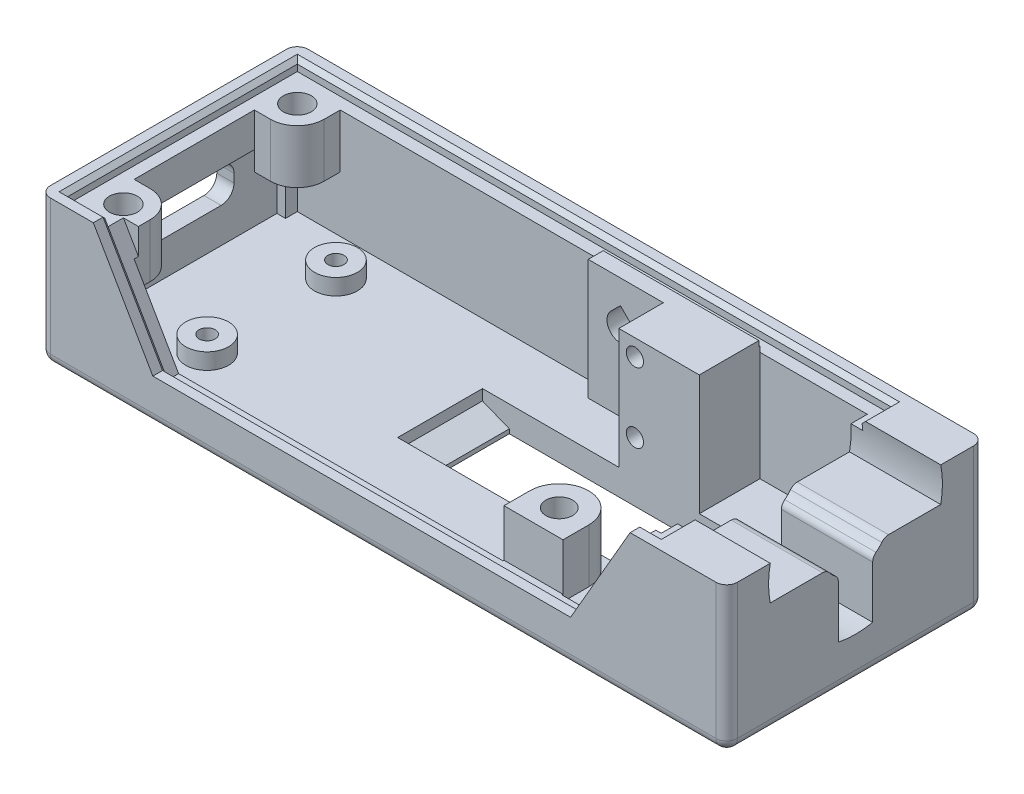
SolidWorks part; units mm, degrees
ref_plane "Ebene vorne" through (0, 0, 0) normal (0, 0, 1) x (1, 0, 0)
ref_plane "Ebene oben" through (0, 0, 0) normal (0, 1, 0) x (1, 0, 0)
ref_plane "Ebene rechts" through (0, 0, 0) normal (1, 0, 0) x (0, 0, -1)
sketch "Skizze1" plane through (0, 0, 0) normal (0, 1, 0) x (1, 0, 0)
  line L0 (-64, 12) -> (0, 12)
  line L1 (-64, 12) -> (-64, -12)
  line L2 (0, 12) -> (0, -12)
  line L3 (-64, -12) -> (0, -12)
  point P0 (0, 0)
  point P1 (-23.1368, 0)
  dimension "D1" = 24
  dimension "D2" = 64
extrude "Aufsatz-Linear austragen1" add sketch "Skizze1" along normal blind 2.4
sketch "Skizze2" plane through (0, 2.4, 0) normal (0, 1, 0) x (1, 0, 0)
  line L1 (0, 12) -> (-64, 12)
  line L2 (0, 12) -> (0, -12)
  line L3 (0, -12) -> (-64, -12)
  line L4 (-64, 12) -> (-64, -12)
  line L5 (-61.6, 9.6) -> (-8.5, 9.6)
  line L6 (-61.6, 9.6) -> (-61.6, -9.6)
  line L7 (-61.6, -9.6) -> (-8.5, -9.6)
  line L8 (-8.5, 9.6) -> (-8.5, -9.6)
  dimension "D1" = 8.5
  dimension "D2" = 2.4
  dimension "D3" = 2.4
  dimension "D4" = 2.4
extrude "Aufsatz-Linear austragen2" add sketch "Skizze2" along normal blind 11.2
sketch "Skizze3" plane through (0, 0, 0) normal (1, 0, 0) x (0, 0, -1)
  line L0 (-12, 0) -> (12, 0) construction
  line L2 (-8.1, 12) -> (8.1, 12) construction
  line L3 (-7.9404, 13.6) -> (7.9404, 13.6)
  line L5 (-7.9404, 10.4) -> (-3.0741, 10.4)
  line L6 (7.9404, 10.4) -> (3.0741, 10.4)
  line L7 (0, 0) -> (0, 12) construction
  line L8 (-1.6, 4.0596) -> (-1.6, 8.9259)
  line L9 (1.6, 8.9259) -> (1.6, 4.0596)
  arc A0 (-2.4435, 10.0923) -> (-1.9077, 9.5565) centre (0, 12) ccw
  arc A1 (-7.9404, 13.6) -> (-7.9404, 10.4) centre (0, 12) ccw
  arc A2 (-1.6, 4.0596) -> (1.6, 4.0596) centre (0, 12) ccw
  arc A3 (7.9404, 10.4) -> (7.9404, 13.6) centre (0, 12) ccw
  arc A4 (1.9077, 9.5565) -> (2.4435, 10.0923) centre (0, 12) ccw
  arc A5 (3.0741, 10.4) -> (2.4435, 10.0923) centre (3.0741, 9.6) ccw
  arc A6 (1.6, 8.9259) -> (1.9077, 9.5565) centre (2.4, 8.9259) cw
  arc A7 (-1.6, 8.9259) -> (-1.9077, 9.5565) centre (-2.4, 8.9259) ccw
  arc A8 (-3.0741, 10.4) -> (-2.4435, 10.0923) centre (-3.0741, 9.6) cw
  point P11 (2.6552, 10.4)
  point P21 (1.6, 9.3448)
  point P26 (-2.6552, 10.4)
  dimension "D1" = 12
  dimension "D2" = 6.2
  dimension "D3" = 16.2
  dimension "D8" = 0.8
  dimension "D4" = 3.2
  dimension "D5" = 1.6
  dimension "D6" = 3.2
  dimension "D7" = 1.6
extrude "Kopf_Loch" cut sketch "Skizze3" against normal up to surface (8.5 mm away)
sketch "Skizze5" plane through (0, 2.4, 0) normal (0, 1, 0) x (1, 0, 0)
  line L0 (-8.5, 9.6) -> (-61.6, 9.6) construction
  line L1 (-26, 9.6) -> (-18.5, 9.6)
  line L2 (-26, 9.6) -> (-26, 3.95)
  line L3 (-26, 3.95) -> (-18.5, 3.95)
  line L4 (-18.5, 9.6) -> (-18.5, 3.95)
  line L6 (-8.5, -9.6) -> (-8.5, 9.6) construction
  dimension "D1" = 10
  dimension "D2" = 7.5
  dimension "D3" = 5.65
extrude "Aufsatz-Linear austragen3" add sketch "Skizze5" along normal up to surface (11.2 mm away)
sketch "Skizze7" plane through (0, 0, -3.95) normal (0, 0, 1) x (1, 0, 0)
  line L0 (-26, 13.6) -> (-26, 2.4) construction
  line L2 (-24.5, 12.05) -> (-24.5, 5.55) construction
  line L5 (-26, 2.4) -> (-18.5, 2.4) construction
  circle A0 centre (-24.5, 12.05) radius 0.8
  circle A1 centre (-24.5, 5.55) radius 0.8
  dimension "D1" = 1.6
  dimension "D2" = 1.6
  dimension "D3" = 6.5
  dimension "D4" = 1.5
  dimension "D5" = 3.15
extrude "Schnitt-Linear austragen2" cut sketch "Skizze7" against normal blind 5
sketch "Skizze8" plane through (-26, 0, 0) normal (-1, 0, 0) x (0, 0, 1)
  line L0 (-9.6, 13.6) -> (-9.6, 2.4) construction
  line L1 (-9.6, 2.4) -> (-3.95, 2.4) construction
  line L2 (-5.1, 10.6678) -> (-5.9839, 9.7839)
  line L3 (-5.1, 10.6678) -> (-4.2161, 9.7839)
  line L4 (-5.1, 8.9) -> (-5.1, 10.6678) construction
  line L5 (-12, 0) -> (12, 0) construction
  arc A0 (-5.9839, 9.7839) -> (-4.2161, 9.7839) centre (-5.1, 8.9) ccw
  dimension "D2" = 6.5
  dimension "D3" = 2.5
  dimension "D1" = 4.5
  dimension "D4" = 90
  dimension "D5" = 90
extrude "Schnitt-Linear austragen3" [suppressed] cut sketch "Skizze8" against normal up to surface (7.5 mm away)
sketch "Skizze9" plane through (0, 0, 12) normal (0, 0, 1) x (1, 0, 0)
  line L0 (-59, 13.6) -> (-53.4574, 4)
  line L1 (-64, 13.6) -> (0, 13.6) construction
  line L2 (-53.4574, 4) -> (-14.5426, 4)
  line L3 (-14.5426, 4) -> (-9, 13.6)
  line L4 (-9, 13.6) -> (-59, 13.6)
  line L5 (-64, 13.6) -> (-64, 0) construction
  line L6 (-64, 0) -> (0, 0) construction
  line L8 (0, 13.6) -> (0, 0) construction
  dimension "D1" = 5
  dimension "D2" = 30
  dimension "D3" = 4
  dimension "D4" = 9
  dimension "D5" = 30
extrude "Schnitt-Linear austragen4" cut sketch "Skizze9" against normal up to surface (2.4 mm away)
sketch "Skizze10" plane through (0, 13.6, 0) normal (0, 1, 0) x (1, 0, 0)
  line L0 (-8.5, 7.9404) -> (-8.5, 9.6)
  line L1 (-8.5, 9.6) -> (-61.6, 9.6)
  line L2 (-61.6, 9.6) -> (-61.6, -9.6)
  line L3 (-61.6, -9.6) -> (-8.5, -9.6)
  line L4 (-8.5, -9.6) -> (-8.5, -7.9404)
  line L5 (-7.4, 7.9404) -> (-7.4, 10.7)
  line L6 (-7.4, 10.7) -> (-62.7, 10.7)
  line L7 (-62.7, 10.7) -> (-62.7, -10.7)
  line L8 (-62.7, -10.7) -> (-7.4, -10.7)
  line L9 (-7.4, -10.7) -> (-7.4, -7.9404)
  line L10 (-7.4, 7.9404) -> (-8.5, 7.9404)
  line L11 (-7.4, -7.9404) -> (-8.5, -7.9404)
  dimension "D1" = 1.1
extrude "Schnitt-Linear austragen15" cut sketch "Skizze10" against normal blind 1
sketch "Skizze19" plane through (0, 0, 9.6) normal (0, 0, -1) x (-1, 0, 0)
  line L1 (9.5774, 12.6) -> (14.5426, 4)
  line L2 (14.5426, 4) -> (9.5774, 12.6) construction
  line L3 (14.5426, 4) -> (53.4574, 4)
  line L4 (53.4574, 4) -> (58.4226, 12.6)
  line L5 (58.4226, 12.6) -> (58.4226, 11.6) construction
  line L6 (58.4226, 11.6) -> (53.4574, 3)
  line L7 (53.4574, 3) -> (14.5426, 3)
  line L8 (9, 12.6) -> (14.5426, 3)
  line L9 (14.5426, 4) -> (14.5426, 3) construction
  line L10 (8.5, 12.6) -> (9.5774, 12.6) construction
  line L11 (9.5774, 12.6) -> (9, 12.6)
  line L12 (9.5774, 12.6) -> (9.5774, 11.6) construction
  line L13 (58.4226, 11.6) -> (59, 12.6)
  line L14 (58.4226, 12.6) -> (61.6, 12.6) construction
  line L15 (59, 12.6) -> (58.4226, 12.6)
  dimension "D1" = 1
  dimension "D2" = 1
extrude "Schnitt-Linear austragen16" cut sketch "Skizze19" against normal blind 1.1
sketch "Skizze20" plane through (0, 0, -9.6) normal (0, 0, 1) x (1, 0, 0)
  line L0 (-26, 12.6) -> (-26, 2.4) construction
  line L1 (-26, 2.4) -> (-33, 2.4)
  line L2 (-26, 2.4) -> (-26, 13.6)
  line L3 (-26, 13.6) -> (-33, 13.6)
  line L4 (-33, 2.4) -> (-33, 13.6)
  line L5 (-18.5, 13.6) -> (-26, 13.6) construction
  circle A0 centre (-30, 9.6) radius 1.5 construction
  circle A1 centre (-30, 9.6) radius 2.75 construction
  dimension "D1" = 3
  dimension "D2" = 5.5
  dimension "D3" = 3
  dimension "D4" = 7
  dimension "D5" = 0
  dimension "D6" = 4
extrude "Aufsatz-Linear austragen4" add sketch "Skizze20" along normal blind 1.5 contours L4 L3 L2 L1
sketch "Skizze22" plane through (0, 0, -8.1) normal (0, 0, 1) x (1, 0, 0)
  line L0 (-30, 9.6) -> (-30, 11.3626) construction
  line L1 (-30, 11.3626) -> (-30.8813, 10.4865)
  line L2 (-30, 11.3626) -> (-29.2144, 10.5723)
  arc A0 (-30.8813, 10.4865) -> (-29.2144, 10.5723) centre (-30, 9.6) ccw
  dimension "D1" = 2.5
  dimension "D2" = 90
extrude "Schnitt-Linear austragen17" cut sketch "Skizze22" against normal blind 2.5
sketch "Skizze23" plane through (0, 13.6, 0) normal (0, 1, 0) x (1, 0, 0)
  line L0 (-3.25, 8.75) -> (-3.25, -8.75) construction
  line L1 (0, 7.9404) -> (0, 12) construction
  line L2 (0, 12) -> (-64, 12) construction
  line L3 (-9, -12) -> (0, -12) construction
  circle A0 centre (-3.25, 8.75) radius 1.25
  circle A1 centre (-3.25, -8.75) radius 1.25
  dimension "D1" = 3.25
  dimension "D2" = 3.25
  dimension "D3" = 3.25
  dimension "D4" = 2.5
  dimension "D5" = 2.5
extrude "ScrewholeFront" [suppressed] cut sketch "Skizze23" against normal blind 10
sketch "Skizze24" [suppressed] plane through (0, 2.4, 0) normal (0, 1, 0) x (1, 0, 0)
  line L3 (-20, 8) -> (-12, 8) construction
  line L9 (-8.5, 13.6) -> (-20.5, 13.6)
  line L10 (-8.5, 13.6) -> (-8.5, 2.7)
  line L11 (-8.5, 2.7) -> (-20.5, 2.7)
  line L12 (-20.5, 13.6) -> (-20.5, 2.7)
  line L13 (-8.5, -13.6) -> (-24, -13.6)
  line L14 (-8.5, -13.6) -> (-8.5, -3.6)
  line L15 (-8.5, -3.6) -> (-24, -3.6)
  line L16 (-24, -13.6) -> (-24, -3.6)
  circle A2 centre (-12, -8) radius 3.2 construction
  circle A3 centre (-20, -8) radius 3.2 construction
  circle A4 centre (-20, 0) radius 3.2 construction
  circle A5 centre (-20, 8) radius 3.2 construction
  circle A6 centre (-12, 0) radius 3.2 construction
  circle A7 centre (-12, 8) radius 3.2 construction
  point P0 (-16, 8)
  dimension "D2" = 12
  dimension "D3" = 6.4
  dimension "D4" = 10
  dimension "D1" = 8
  dimension "D7" = 0.8
  dimension "D8" = 8
  dimension "D5" = 2
  dimension "D6" = 3
extrude "Aufsatz-Linear austragen5" [suppressed] add sketch "Skizze24" along normal blind 5.4
sketch "Skizze25" [suppressed] plane through (0, 0, 0) normal (0, -1, 0) x (1, 0, 0)
  line L0 (0, 16) -> (0, -16) construction
  line L1 (-12, 8) -> (-12, -8) construction
  line L2 (-12, -8) -> (-20, -8) construction
  line L3 (-20, -8) -> (-20, 8) construction
  line L4 (-20, 8) -> (-12, 8) construction
  circle A0 centre (-12, 8) radius 2.4
  circle A1 centre (-20, 8) radius 2.4
  circle A2 centre (-20, 0) radius 2.4 construction
  circle A3 centre (-20, -8) radius 2.4
  circle A4 centre (-12, 0) radius 2.4 construction
  circle A5 centre (-12, -8) radius 2.4
  dimension "D1" = 4.8
  dimension "D2" = 12
  dimension "D5" = 8
  dimension "D6" = 8
  dimension "D3" = 2
  dimension "D4" = 3
extrude "Schnitt-Linear austragen19" [suppressed] cut sketch "Skizze25" against normal up to surface (7.8 mm away)
sketch "Skizze26" [suppressed] plane through (0, 0, 0) normal (0, -1, 0) x (1, 0, 0)
  circle A0 centre (-12, 8) radius 3.2
  circle A1 centre (-20, 8) radius 3.2
  circle A2 centre (-20, -8) radius 3.2
  circle A3 centre (-12, -8) radius 3.2
  dimension "D1" = 6.4
  dimension "D2" = 6.4
  dimension "D3" = 6.4
  dimension "D4" = 6.4
extrude "Schnitt-Linear austragen20" [suppressed] cut sketch "Skizze26" against normal blind 0.8
sketch "Skizze27" [suppressed] plane through (0, 7.8, 0) normal (0, 1, 0) x (1, 0, 0)
  circle A0 centre (-20, 8) radius 3.2
  circle A1 centre (-12, 8) radius 3.2
  circle A2 centre (-20, -8) radius 3.2
  circle A3 centre (-12, -8) radius 3.2
  dimension "D1" = 6.4
  dimension "D2" = 6.4
  dimension "D3" = 6.4
  dimension "D4" = 6.4
extrude "Schnitt-Linear austragen21" [suppressed] cut sketch "Skizze27" against normal blind 0.8 and the other way up to surface
sketch "Skizze31" [suppressed] plane through (0, 0, 13.6) normal (0, 0, 1) x (1, 0, 0)
  line L0 (-24, 7.8) -> (-14.0807, 7.8)
  line L1 (-14.0807, 7.8) -> (-16.852, 3)
  line L2 (-16.852, 3) -> (-24, 3)
  line L3 (-24, 3) -> (-24, 7.8)
extrude "Schnitt-Linear austragen24" [suppressed] cut sketch "Skizze31" against normal blind 1
sketch "Skizze28" plane through (-61.6, 0, 0) normal (1, 0, 0) x (0, 0, -1)
  line L0 (0, 0) -> (0, 7.2073) construction
  line L2 (9.6, 2.4) -> (-9.6, 2.4) construction
  line L3 (8.5, 9.4) -> (-8.5, 9.4)
  line L4 (8.5, 9.4) -> (8.5, 2.4)
  line L5 (8.5, 2.4) -> (-8.5, 2.4)
  line L6 (-8.5, 9.4) -> (-8.5, 2.4)
  line L7 (8.5, 9.4) -> (-8.5, 2.4) construction
  line L8 (8.5, 2.4) -> (-8.5, 9.4) construction
  point P3 (0, 5.9)
  dimension "D1" = 17
  dimension "D2" = 7
extrude "Schnitt-Linear austragen22" cut sketch "Skizze28" against normal offset from surface (0.8 mm away) 1.6
sketch "Skizze29" plane through (-64, 0, 0) normal (-1, 0, 0) x (0, 0, 1)
  line L0 (0, 0) -> (0, 14.8957) construction
  line L1 (-4.6, 3.9) -> (4.6, 3.9) construction
  line L2 (3.3, 8.85) -> (-3.3, 8.85)
  line L3 (4.5, 7.65) -> (4.5, 6.85)
  line L4 (3.3, 5.65) -> (-3.3, 5.65)
  line L5 (-4.5, 7.65) -> (-4.5, 6.85)
  line L6 (4.5, 8.85) -> (-4.5, 5.65) construction
  line L7 (4.5, 5.65) -> (-4.5, 8.85) construction
  arc A0 (-3.3, 5.65) -> (-4.5, 6.85) centre (-3.3, 6.85) cw
  arc A1 (4.5, 6.85) -> (3.3, 5.65) centre (3.3, 6.85) cw
  arc A2 (3.3, 8.85) -> (4.5, 7.65) centre (3.3, 7.65) cw
  arc A3 (-3.3, 8.85) -> (-4.5, 7.65) centre (-3.3, 7.65) ccw
  point P3 (0, 7.25)
  dimension "D5" = 1.2
  dimension "D1" = 3.2
  dimension "D2" = 9
  dimension "D3" = 1.75
  dimension "D4" = 3.9
extrude "Schnitt-Linear austragen23" cut sketch "Skizze29" against normal up to surface (1.6 mm away)
sketch "Skizze39" plane through (0, 2.4, 0) normal (0, 1, 0) x (1, 0, 0)
  line L1 (-62.7, 0) -> (-43.7855, 0) construction
  line L2 (-62.7, 10.7) -> (-62.7, -10.7) construction
  line L3 (-62.4, 8.5) -> (-62.4, -8.5) construction
  circle A0 centre (-54.4, 6) radius 2
  circle A1 centre (-54.4, 6) radius 0.75
  circle A2 centre (-54.4, -6) radius 0.75
  circle A3 centre (-54.4, -6) radius 2
  dimension "D1" = 4
  dimension "D2" = 1.5
  dimension "D3" = 6
  dimension "D4" = 8
extrude "Mounting" add sketch "Skizze39" along normal blind 1.5
sketch "Skizze33" plane through (0, 12.6, 0) normal (0, 1, 0) x (1, 0, 0)
  line L0 (-61.6, -9.6) -> (-61.6, 9.6) construction
  line L1 (-61.6, 9.6) -> (-33, 9.6) construction
  line L2 (-57.6, 8.1) -> (-57.6, 9.6)
  line L7 (-61.6, 5.6) -> (-60.1, 5.6)
  line L8 (0, 0) -> (-68.5051, 0) construction
  line L14 (-61.6, 9.6) -> (-61.6, 5.6)
  line L15 (-61.6, 9.6) -> (-57.6, 9.6)
  line L16 (-61.6, -9.6) -> (-57.6, -9.6)
  line L17 (-61.6, -9.6) -> (-61.6, -5.6)
  line L18 (-61.6, -5.6) -> (-60.1, -5.6)
  line L19 (-57.6, -8.1) -> (-57.6, -9.6)
  arc A0 (-60.1, 5.6) -> (-57.6, 8.1) centre (-60.1, 8.1) ccw
  circle A1 centre (-60.1, 8.1) radius 1.3
  circle A4 centre (-60.1, -8.1) radius 1.3
  arc A5 (-60.1, -5.6) -> (-57.6, -8.1) centre (-60.1, -8.1) cw
  dimension "D1" = 5
  dimension "D2" = 2.6
  dimension "D3" = 1.5
  dimension "D4" = 1.5
extrude "Aufsatz-Linear austragen7" add sketch "Skizze33" against normal blind 5
sketch "Skizze34" plane through (0, 0, 9.6) normal (0, 0, 1) x (1, 0, 0)
  line L0 (-59, 12.6) -> (-57.6, 10.1751)
  line L1 (-57.6, 10.1751) -> (-57.6, 12.6)
  line L2 (-57.6, 12.6) -> (-59, 12.6)
extrude "Schnitt-Linear austragen25" cut sketch "Skizze34" against normal blind 0.4
sketch "Skizze35" plane through (0, 0, 0) normal (0, 0, 1) x (1, 0, 0)
  line L0 (-38.7, 1.4) -> (-36.2, 0.4)
  line L2 (-36.2, 0.4) -> (-36.2, 0)
  line L3 (0, 0) -> (-64, 0) construction
  line L4 (-36.2, 0) -> (-12, 0)
  line L8 (-24.1, 0) -> (-24.1, 2.4) construction
  line L9 (-38.7, 1.4) -> (-38.7, 2.4)
  line L10 (-33, 2.4) -> (-61.6, 2.4) construction
  line L11 (-38.7, 2.4) -> (-9.5, 2.4)
  line L12 (-9.5, 1.4) -> (-9.5, 2.4)
  line L13 (-12, 0.4) -> (-12, 0)
  line L14 (-9.5, 1.4) -> (-12, 0.4)
  circle A0 centre (-24.1, 1.2) radius 0.4161 construction
  circle A1 centre (-16.1, 1.2) radius 0.4161 construction
  dimension "D1" = 2.5
  dimension "D2" = 24.2
  dimension "D3" = 12
  dimension "D5" = 1
  dimension "D8" = 0.4
  dimension "D7" = 2
extrude "Lego_MountingHole" cut sketch "Skizze35" against normal blind 3.95 and the other way blind 3.95
sketch "Skizze36" plane through (0, 2.4, 0) normal (0, 1, 0) x (1, 0, 0)
  line L3 (-23.25, -7.1) -> (-23.25, -9.6)
  line L4 (-23.25, -9.6) -> (-17.75, -9.6)
  line L5 (-17.75, -9.6) -> (-17.75, -7.1)
  line L9 (-61.6, -9.6) -> (-8.5, -9.6) construction
  line L10 (-8.5, -8.0777) -> (-8.5, -9.6) construction
  circle A0 centre (-20.5, -7.1) radius 1.25
  arc A2 (-17.75, -7.1) -> (-23.25, -7.1) centre (-20.5, -7.1) ccw
  dimension "D1" = 2.5
  dimension "D2" = 12
  dimension "D3" = 2.75
  dimension "D5" = 2.5
extrude "Aufsatz-Linear austragen8" add sketch "Skizze36" along normal blind 5
sketch "Skizze37" plane through (0, 0, 9.6) normal (0, 0, 1) x (1, 0, 0)
  line L1 (-23.25, 7.4) -> (-17.75, 7.4)
  line L2 (-23.25, 7.4) -> (-23.25, 3)
  line L3 (-23.25, 3) -> (-17.75, 3)
  line L4 (-17.75, 7.4) -> (-17.75, 3)
extrude "Schnitt-Linear austragen27" cut sketch "Skizze37" against normal blind 0.1
sketch "Skizze38" plane through (0, 0, -9.6) normal (0, 0, -1) x (-1, 0, 0)
  line L0 (33, 12.6) -> (33, 13.6) construction
  line L1 (18.5, 13.6) -> (33, 13.6)
  line L2 (18.5, 13.6) -> (18.5, 13.1)
  line L3 (18.5, 13.1) -> (33, 13.1)
  line L4 (33, 13.6) -> (33, 13.1)
extrude "Schnitt-Linear austragen28" cut sketch "Skizze38" against normal blind 0.1
chamfer "Fase1" distance 0.4 angle 45 9 edges at (-7.4, 13.6, -9.3202) (-7.4, 13.6, 9.3202) (-8.2, 13.6, 10.7) (-11.7713, 8.8, 10.7) (-34, 4, 10.7) (-56.2287, 8.8, 10.7) (-60.85, 13.6, 10.7) (-62.7, 13.6, 0) (-35.05, 13.6, -10.7)
fillet "Verrundung1" radius 1 8 edges at (-64, 6.8, 12) (-64, 0, 0) (-32, 0, -12) (-64, 6.8, -12) (0, 6.8, -12) (0, 0, 0) (-32, 0, 12) (0, 6.8, 12)
